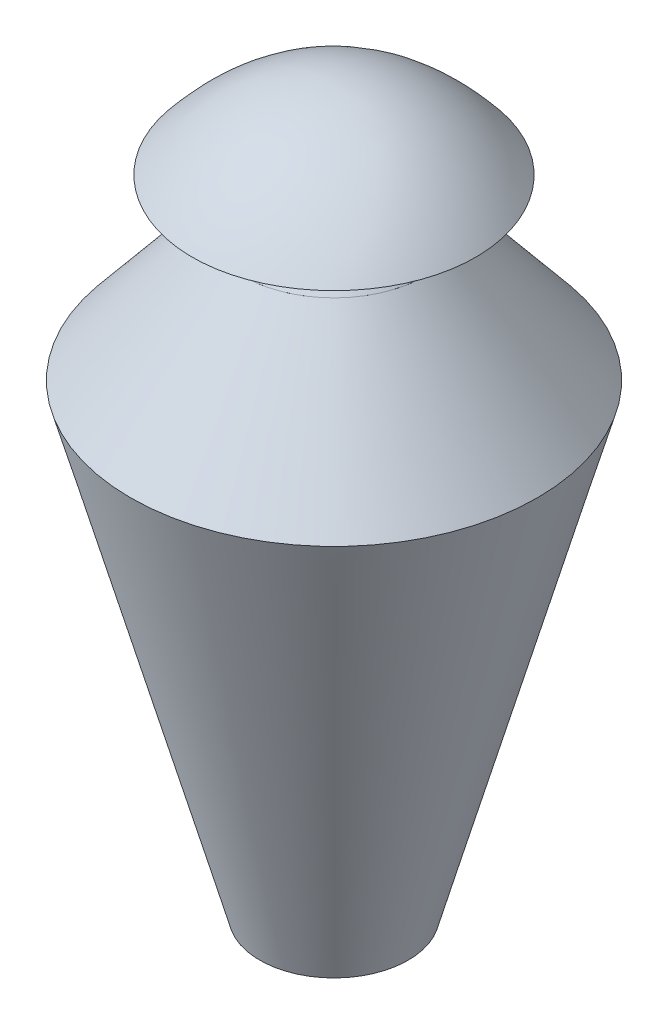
SolidWorks part; units mm, degrees
ref_plane "Front" through (0, 0, 0) normal (0, 0, 1) x (1, 0, 0)
ref_plane "Top" through (0, 0, 0) normal (0, 1, 0) x (1, 0, 0)
ref_plane "Right" through (0, 0, 0) normal (1, 0, 0) x (0, 0, -1)
sketch "Sketch1" plane through (0, 0, 0) normal (0, 0, 1) x (1, 0, 0)
  line L0 (0, 0) -> (0, 100) construction
  line L1 (11.3512, 0) -> (31.088, 71.0778)
  line L2 (31.088, 71.0778) -> (13.9563, 91.8668)
  line L3 (13.9563, 91.8668) -> (6.6179, 0)
  line L4 (6.6179, 0) -> (11.3512, 0)
  dimension "D1" = 100
revolve "Revolve1" add sketch "Sketch1" angle 360 about L0
surface "Surface-Fill3"
surface "Surface-Offset1" parameters "D1"=10
